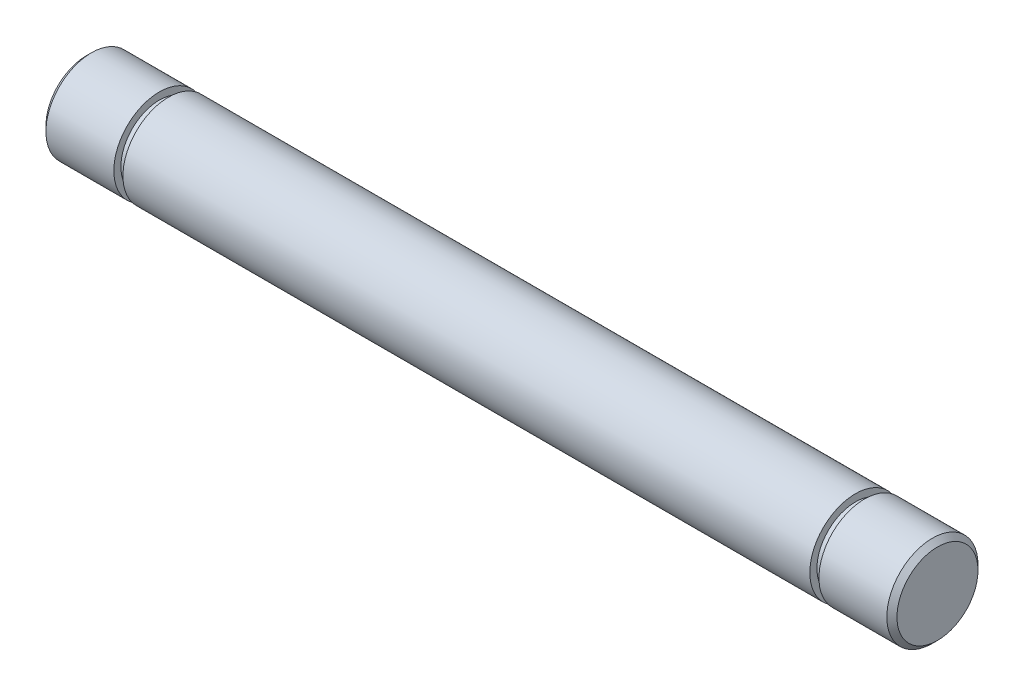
SolidWorks part; units mm, degrees
ref_plane "Face" through (0, 0, 0) normal (0, 0, 1) x (1, 0, 0)
ref_plane "Dessus" through (0, 0, 0) normal (0, 1, 0) x (1, 0, 0)
ref_plane "Droite" through (0, 0, 0) normal (1, 0, 0) x (0, 0, -1)
sketch "Esquisse1" plane through (0, 0, 0) normal (0, 0, 1) x (1, 0, 0)
  line L0 (124.2971, 0) -> (-48.5996, 0) construction
  line L1 (0, 0) -> (84, 0)
  line L2 (0, 0) -> (0, 4)
  line L3 (0.5, 4.5) -> (7.2, 4.5)
  line L4 (84, 0) -> (84, 4)
  line L5 (0, 4) -> (0.5, 4.5)
  line L6 (83.5, 4.5) -> (84, 4)
  line L7 (76.8, 4.5) -> (83.5, 4.5)
  line L9 (7.2, 4.5) -> (7.2, 3.8)
  line L10 (7.2, 3.8) -> (8.1, 3.8)
  line L11 (8.1, 4.5) -> (8.1, 3.8)
  line L12 (8.1, 4.5) -> (75.9, 4.5)
  line L13 (75.9, 4.5) -> (75.9, 3.8)
  line L14 (75.9, 3.8) -> (76.8, 3.8)
  line L15 (76.8, 4.5) -> (76.8, 3.8)
  point P1 (84, 4.5)
  point P2 (0, 4.5)
  dimension "D1" = 9
  dimension "D2" = 84
  dimension "D5" = 0.5
  dimension "D6" = 0.5
  dimension "D3" = 0.9
  dimension "D4" = 0.9
  dimension "D7" = 7.6
  dimension "D8" = 7.6
  dimension "D9" = 69.6
  dimension "D10" = 7.2
revolve "Révolution1" add sketch "Esquisse1" angle 360 about L0
